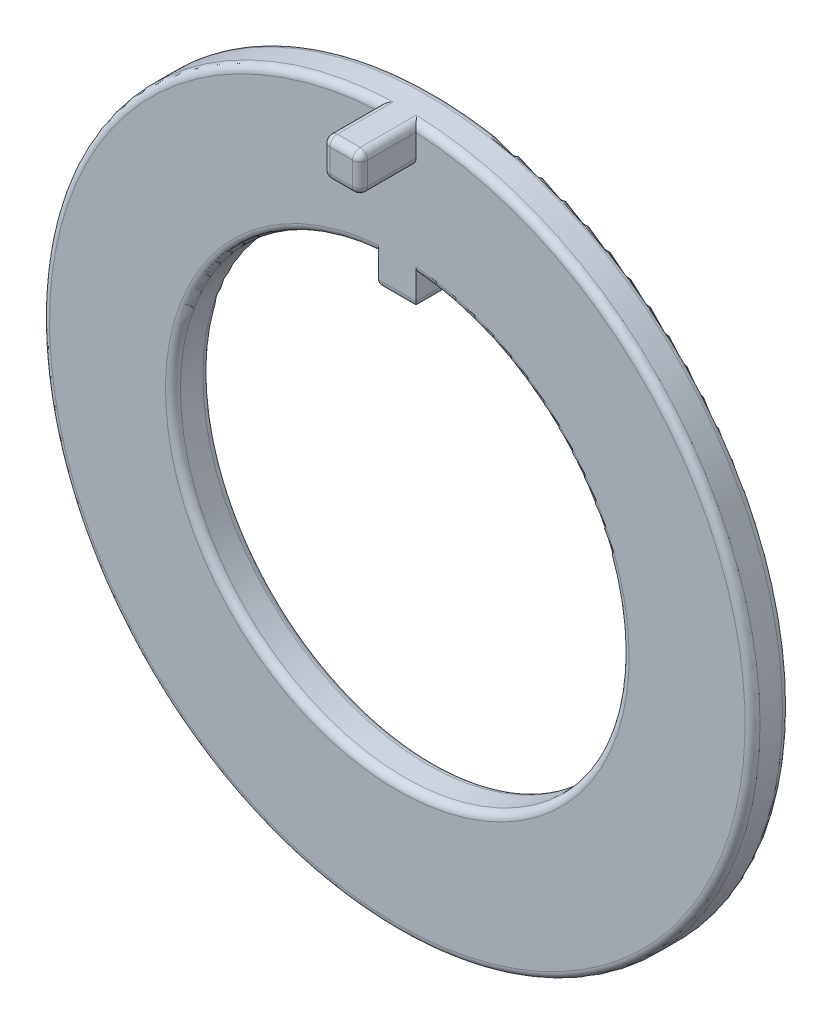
SolidWorks part; units mm, degrees
ref_plane "Plan de face" through (0, 0, 0) normal (0, 0, 1) x (1, 0, 0)
ref_plane "Plan de dessus" through (0, 0, 0) normal (0, 1, 0) x (1, 0, 0)
ref_plane "Plan de droite" through (0, 0, 0) normal (1, 0, 0) x (0, 0, -1)
sketch "Esquisse1" plane through (0, 0, 0) normal (0, 0, 1) x (1, 0, 0)
  line L0 (-10.9331, 0) -> (11.8636, 0) construction
  line L1 (0, -12.4326) -> (0, 10.8284) construction
  line L2 (-0.5, 5.9791) -> (-0.5, 5.1791)
  line L3 (-0.5, 5.1791) -> (0.5, 5.1791)
  line L4 (0.5, 5.1791) -> (0.5, 5.9791)
  arc A0 (-0.5, 5.9791) -> (0.5, 5.9791) centre (0, 0) ccw
  circle A1 centre (0, 0) radius 9.5
  dimension "D1" = 6
  dimension "D2" = 19
  dimension "D3" = 0.5
  dimension "D4" = 1
  dimension "D5" = 0.8
extrude "Boss.-Extru.1" add sketch "Esquisse1" along normal blind 1
fillet "Congé1" radius 0.2 3 edges at (0, -6, 0) (9.5, 0, 0) (0, -6, 1)
sketch "Esquisse3" plane through (0, 0, 1) normal (0, 0, 1) x (1, 0, 0)
  line L0 (-0.5, 9.4868) -> (-0.5, 8.4868)
  line L1 (-0.5, 8.4868) -> (0.5, 8.4868)
  line L2 (0.5, 8.4868) -> (0.5, 9.4868)
  line L3 (-0.5, 5.1791) -> (-0.5, 6.1798) construction
  circle A0 centre (0, 0) radius 9.5 construction
  circle A2 centre (0, 0) radius 9.5
  arc A3 (0.5, 9.4868) -> (-0.5, 9.4868) centre (0, 0) ccw
  point P7 (-0.5, 5.6795)
  dimension "D1" = 1
  dimension "D4" = 0
  dimension "D2" = 1
  dimension "D3" = 0
extrude "Boss.-Extru.3" add sketch "Esquisse3" along normal blind 1.5
fillet "Congé4" radius 0.2 4 edges at (-0.5, 9.4868, 1.75) (-0.5, 8.4868, 1.75) (0.5, 8.4868, 1.75) (0.5, 9.4868, 1.75)
fillet "Congé5" radius 0.2 1 edges at (0, -9.5, 1)
fillet "Congé6" radius 0.2 8 edges at (0.4437, 9.4343, 2.5) (0.4414, 8.5454, 2.5) (-0.4414, 8.5454, 2.5) (-0.4437, 9.4343, 2.5) (-0.5, 8.991, 2.5) (0, 8.4868, 2.5) (0.5, 8.991, 2.5) (0, 9.5, 2.5)
fillet "Congé7" radius 0.2 4 edges at (0, 5.1791, 0) (-0.5, 5.1791, 0.5) (0, 5.1791, 1) (0.5, 5.1791, 0.5)
